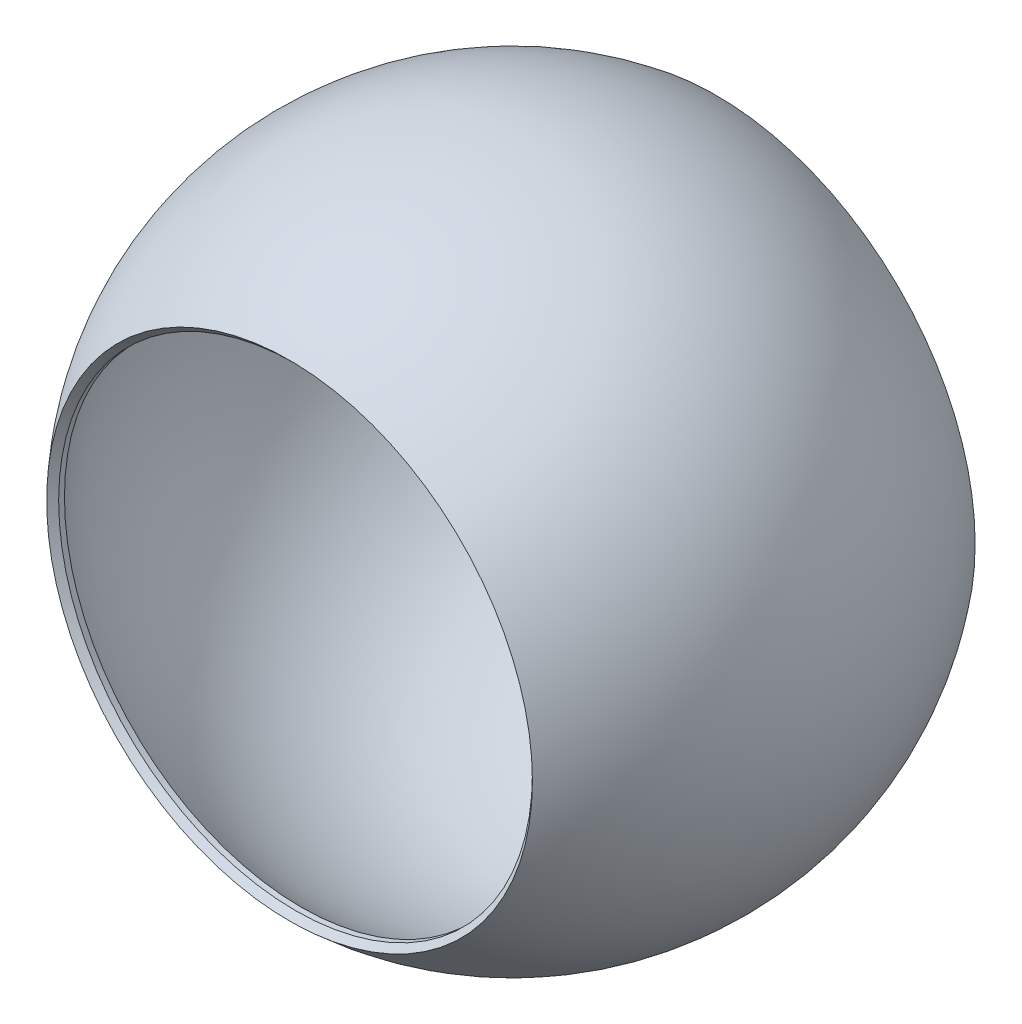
SolidWorks part; units mm, degrees
ref_plane "Plan de face" through (0, 0, 0) normal (0, 0, 1) x (1, 0, 0)
ref_plane "Plan de dessus" through (0, 0, 0) normal (0, 1, 0) x (1, 0, 0)
ref_plane "Plan de droite" through (0, 0, 0) normal (1, 0, 0) x (0, 0, -1)
sketch "Esquisse1" plane through (0, 0, 0) normal (0, 0, 1) x (1, 0, 0)
  line L0 (0, 80) -> (0, 77)
  line L1 (0, -77) -> (0, -80)
  arc A0 (0, 80) -> (0, -80) centre (0, 0) ccw
  arc A1 (0, 77) -> (0, -77) centre (0, 0) ccw
  dimension "D1" = 80
  dimension "D2" = 77
revolve "Révolution1" add sketch "Esquisse1" angle 360 about L0
sketch "Esquisse2" plane through (0, 0, 0) normal (0, 0, 1) x (1, 0, 0)
  circle A0 centre (0, 0) radius 57.5
  dimension "D1" = 115
extrude "Extrusion1" cut sketch "Esquisse2" along normal through all
sketch "Esquisse3" plane through (0, 0, 0) normal (0, 0, 1) x (1, 0, 0)
  circle A0 centre (0, 0) radius 61
  dimension "D1" = 122
extrude "Extrusion2" cut sketch "Esquisse3" against normal through all
chamfer "Chanfrein1" distance 3 angle 45 2 edges at (-57.5, 0, 55.6215) (61, 0, -51.7591)
